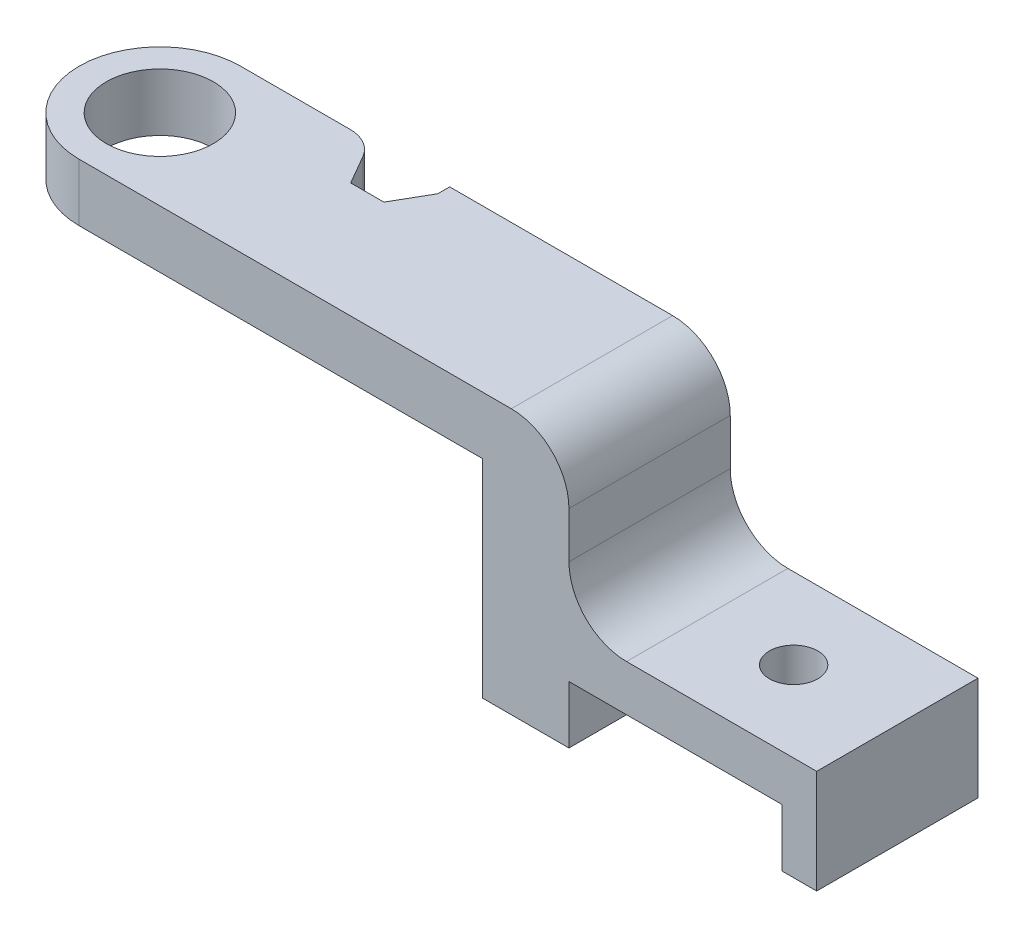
SolidWorks part; units mm, degrees
ref_plane "Front Plane" through (0, 0, 0) normal (0, 0, 1) x (1, 0, 0)
ref_plane "Top Plane" through (0, 0, 0) normal (0, 1, 0) x (1, 0, 0)
ref_plane "Right Plane" through (0, 0, 0) normal (1, 0, 0) x (0, 0, -1)
sketch "Sketch1" plane through (0, 0, 0) normal (0, 0, 1) x (1, 0, 0)
  line L0 (0, 0) -> (0, 5)
  line L1 (0, 5) -> (49.5, 5)
  line L2 (49.5, 5) -> (49.5, -9)
  line L6 (42, -18) -> (42, 0)
  line L7 (42, 0) -> (0, 0)
  line L8 (42, -18) -> (49.5, -18)
  line L9 (49.5, -18) -> (49.5, -13)
  line L10 (49.5, -13) -> (68, -13)
  line L12 (71, -9) -> (49.5, -9)
  line L14 (71, -18) -> (68, -18)
  line L15 (68, -18) -> (68, -13)
  line L16 (71, -18) -> (71, -9)
  point P3 (69.5, -18)
  dimension "D1" = 5
  dimension "D2" = 42
  dimension "D3" = 18
  dimension "D4" = 7.5
  dimension "D5" = 5
  dimension "D6" = 20
  dimension "D7" = 3
  dimension "D8" = 4
extrude "Boss-Extrude1" add sketch "Sketch1" along normal blind 14
sketch "Sketch2" plane through (0, -9, 0) normal (0, 1, 0) x (1, 0, 0)
  line L0 (0, -7) -> (71, -7) construction
  line L1 (0, -14) -> (0, 0) construction
  line L2 (71, -14) -> (71, 0) construction
  circle A0 centre (62, -7) radius 2.1
  dimension "D1" = 4.2
  dimension "D2" = 9
extrude "Cut-Extrude1" cut sketch "Sketch2" against normal blind 8
sketch "Sketch3" plane through (0, 5, 0) normal (0, 1, 0) x (1, 0, 0)
  line L0 (0, -7) -> (49.5, -7) construction
  line L1 (0, -14) -> (0, 0) construction
  line L2 (49.5, -14) -> (49.5, 0) construction
  line L3 (0, -7) -> (0, 0)
  line L4 (0, 0) -> (7, 0)
  line L5 (0, -7) -> (0, -14)
  line L6 (49.5, -14) -> (0, -14) construction
  line L7 (0, -14) -> (7, -14)
  circle A0 centre (7, -7) radius 4.65
  arc A1 (7, 0) -> (7, -14) centre (7, -7) ccw
  dimension "D1" = 9.3
  dimension "D2" = 7
extrude "Cut-Extrude2" cut sketch "Sketch3" against normal blind 8 contours A1 M2 M3 | A1 M3 M4 | L0 A0 | A0 L0
fillet "Fillet1" radius 5 2 edges at (49.5, -9, 7) (49.5, 5, 7)
sketch "Sketch4" plane through (0, 5, 0) normal (0, 1, 0) x (1, 0, 0)
  line L0 (19, 0) -> (19, -1) construction
  line L1 (44.5, 0) -> (7, 0) construction
  line L2 (19, -1) -> (20.7321, -4) construction
  line L3 (23.2679, -4) -> (25, -1) construction
  line L4 (25, -1) -> (25, 0) construction
  line L5 (25, 0) -> (19, 0) construction
  line L6 (23.2679, -4) -> (20.7321, -4) construction
  line L7 (23.4412, -4) -> (25.15, -1.0402)
  line L8 (25.15, -1.0402) -> (25.15, 0)
  line L9 (18.85, 0) -> (18.85, -1.0402) construction
  line L10 (18.85, -1.0402) -> (20.5588, -4)
  line L12 (23.4412, -4) -> (20.5588, -4)
  line L14 (25.15, 0) -> (18.85, 0)
  line L15 (23.3979, -4.075) -> (25.15, -1.0402) construction
  line L16 (18.85, -1.0402) -> (20.6021, -4.075) construction
  line L17 (18.85, -1.0402) -> (18.2494, 0)
  line L18 (18.2494, 0) -> (18.85, 0)
  circle A0 centre (7, -7) radius 4.65 construction
  circle A1 centre (7, -7) radius 4.65 construction
  point P11 (22, -4)
  dimension "D1" = 30
  dimension "D2" = 3
  dimension "D3" = 6
  dimension "D4" = 3
  dimension "D5" = 15
  dimension "D6" = 0.15
extrude "Cut-Extrude3" cut sketch "Sketch4" against normal blind 10
fillet "Fillet2" radius 3 1 edges at (18.2494, 2.5, 0)
